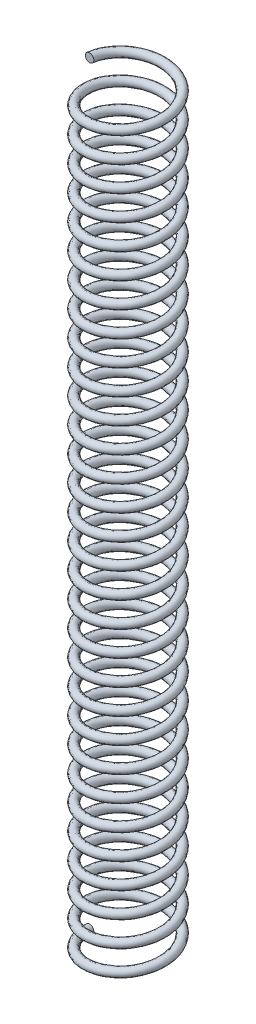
SolidWorks part; units mm, degrees
ref_plane "Front Plane" through (0, 0, 0) normal (0, 0, 1) x (1, 0, 0)
ref_plane "Top Plane" through (0, 0, 0) normal (0, 1, 0) x (1, 0, 0)
ref_plane "Right Plane" through (0, 0, 0) normal (1, 0, 0) x (0, 0, -1)
sketch "Sketch1" plane through (0, 0, 0) normal (0, 0, 1) x (1, 0, 0)
  line L0 (0, 0) -> (0, 96.4769)
  line L1 (-7.6517, 96.4769) -> (1.586, 96.4769) construction
sketch "Sketch2" plane through (0, 0, 0) normal (0, 0, 1) x (1, 0, 0)
  circle A0 centre (-4.9149, 0) radius 0.5461
  point P2 (-5.461, 0)
  point P3 (-4.9149, -0.5461)
  dimension "D1" = 1.0922
  dimension "D2" = 5.461
sweep "Sweep1" add profiles "Sketch2" path "Sketch1" parameters "D1"=10800
ref_plane "Plane1" through (0, -0.5461, 0) normal (0, 1, 0) x (-1, 0, 0)
sketch "Sketch3" plane through (0, -0.5461, 0) normal (0, 1, 0) x (1, 0, 0)
  circle A0 centre (0, 0) radius 4.7602 construction
